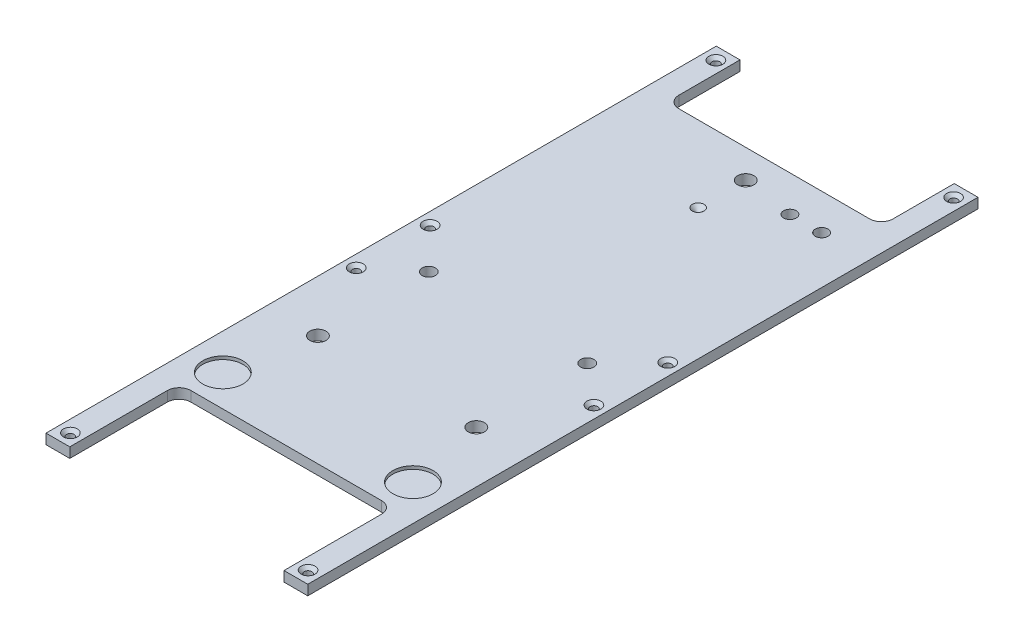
SolidWorks part; units mm, degrees
ref_plane "Front Plane" through (0, 0, 0) normal (0, 0, 1) x (1, 0, 0)
ref_plane "Top Plane" through (0, 0, 0) normal (0, 1, 0) x (1, 0, 0)
ref_plane "Right Plane" through (0, 0, 0) normal (1, 0, 0) x (0, 0, -1)
sketch "Sketch1" plane through (0, 0, 0) normal (0, 1, 0) x (1, 0, 0)
  line L0 (0, 0) -> (0, -130) construction
  line L1 (-41.3, 24) -> (41.3, 24)
  line L2 (-41.3, 24) -> (-41.3, -130)
  line L3 (-41.3, -130) -> (41.3, -130)
  line L4 (41.3, 24) -> (41.3, -130)
  point P0 (0, 0)
  dimension "D1" = 24
  dimension "D2" = 82.6
  dimension "D3" = 130
extrude "Plate" add sketch "Sketch1" along normal blind 3.175
sketch "Sketch32" plane through (0, 0, 0) normal (0, -1, 0) x (1, 0, 0)
  line L0 (-41.3, -24) -> (-41.3, -47)
  line L1 (-41.3, -47) -> (-33.8, -47)
  line L2 (-33.8, -47) -> (-33.8, -24)
  line L3 (41.3, -24) -> (-41.3, -24) construction
  line L4 (-33.8, -24) -> (-41.3, -24)
  line L5 (41.3, -24) -> (33.8, -24)
  line L6 (33.8, -24) -> (33.8, -47)
  line L7 (33.8, -47) -> (41.3, -47)
  line L8 (41.3, -47) -> (41.3, -24)
  line L9 (0, 0) -> (0, -48.1339) construction
  line L11 (-41.3, 130) -> (-33.8, 130)
  line L12 (-41.3, 130) -> (-41.3, 164.5)
  line L13 (-41.3, 164.5) -> (-33.8, 164.5)
  line L14 (-33.8, 130) -> (-33.8, 164.5)
  line L15 (41.3, 130) -> (33.8, 130)
  line L16 (41.3, 130) -> (41.3, 164.5)
  line L17 (41.3, 164.5) -> (33.8, 164.5)
  line L18 (33.8, 130) -> (33.8, 164.5)
  dimension "D1" = 7.5
  dimension "D2" = 23
  dimension "D3" = 211.5
extrude "Boss-Extrude3" add sketch "Sketch32" against normal up to surface (3.175 mm away)
fillet "Fillet1" radius 3.7 4 edges at (33.8, 1.5875, -24) (33.8, 1.5875, 130)
ref_plane "Plane1" through (0, 0, 53) normal (0, 0, 1) x (1, 0, 0)
ref_plane "Plane2" through (0, 0, 21) normal (0, 0, -1) x (-1, 0, 0)
ref_plane "Plane3" through (0, 0, 38) normal (0, 0, 1) x (1, 0, 0)
sketch "Sketch30" plane through (0, 0, 0) normal (0, 0, 1) x (1, 0, 0)
  line L0 (0, 1.325) -> (1.85, 3.175)
  line L1 (-30.1, 3.175) -> (30.1, 3.175) construction
  line L2 (1.85, 3.175) -> (0, 3.175)
  line L3 (0, 3.175) -> (0, 1.325)
  dimension "D1" = 1.85
revolve "Cone" cut sketch "Sketch30" angle 360 about L3
hole_wizard "CSK for M2 Flat Head Machine Screw1" positions "Sketch27" profile "Sketch28" countersink size "M2" standard "ANSI Metric"
sketch "Sketch27" plane through (0, 3.175, 0) normal (0, 1, 0) x (1, 0, 0)
  line L0 (30.1, 24) -> (-30.1, 24) construction
  line L2 (0, 24) -> (0, 0) construction
  line L5 (-37.5, 43.1) -> (-37.5, -47.1) construction
  line L6 (-37.5, -47.1) -> (-37.5, -70.4) construction
  line L9 (-37.5, -58.75) -> (-41.3, -58.75) construction
  line L10 (-41.3, 47) -> (-41.3, -164.5) construction
  point P0 (-37.5, 43.1)
  point P2 (37.5, 43.1)
  point P4 (37.5, -47.1)
  point P6 (-37.5, -47.1)
  point P23 (-37.5, -70.4)
  point P25 (37.5, -70.4)
  point P38 (-37.5, -160.6)
  point P40 (37.5, -160.6)
  dimension "D2" = 75
  dimension "D3" = 90.2
  dimension "D4" = 23.3
  dimension "D5" = 90.2
sketch "Sketch28" plane through (-37.5, 3.175, -43.1) normal (1, 0, 0) x (0, 0, 1)
  line L0 (0, 0) -> (0, 3.175)
  line L1 (0, 3.175) -> (1.2, 3.175)
  line L2 (1.2, 3.175) -> (1.2, 1)
  line L3 (1.2, 1) -> (2.2, 0)
  line L5 (2.2, 0) -> (0, 0)
  line L6 (-1.2, 1) -> (-2.2, 0) construction
  line L11 (0, -6.35) -> (0, 107.95) construction
  dimension "Thru Hole Dia." = 2.4
  dimension "Thru Hole Depth" = 3.175
  dimension "Near C'Sink Dia." = 4.4
  dimension "Near C'Sink Angle" = 90
sketch "Sketch17" plane through (0, 3.175, 0) normal (0, 1, 0) x (1, 0, 0)
  line L0 (0, 24) -> (0, -130) construction
  line L1 (30.1, 24) -> (-30.1, 24) construction
  line L2 (-30.1, -130) -> (30.1, -130) construction
  circle A0 centre (-30, -120) radius 6.35
  circle A1 centre (30, -120) radius 6.35
  dimension "D1" = 12.7
  dimension "D3" = 120
  dimension "D2" = 60
extrude "Flats" cut sketch "Sketch17" against normal blind 1
sketch "Sketch8" plane through (0, 0, 21) normal (0, 0, -1) x (-1, 0, 0)
  line L0 (0, 3.175) -> (0, 1.175)
  line L1 (30.1, 3.175) -> (-30.1, 3.175) construction
  line L2 (0, 1.175) -> (2, 3.175)
  line L3 (2, 3.175) -> (0, 3.175)
  dimension "D1" = 45
  dimension "D2" = 2
  dimension "D3" = 0
revolve "Cone Old" [suppressed] cut sketch "Sketch8" angle 360 about L0
hole_wizard "Bolt Hole 1/4-20 Tapped Hole1" positions "Sketch15" profile "Sketch14" tap size "1/4-20" standard "ANSI Inch"
sketch "Sketch15" plane through (0, 3.175, 0) normal (0, 1, 0) x (1, 0, 0)
  line L1 (-25, -95) -> (25, -95) construction
  line L3 (-30, -120) -> (30, -120) construction
  line L11 (0, -120) -> (0, -95) construction
  line L14 (0, 0) -> (0, -95) construction
  line L15 (0, 0) -> (0, 15) construction
  point P0 (-25, -95)
  point P2 (25, -95)
  point P59 (0, 15)
  dimension "D1" = 50
  dimension "D2" = 25
  dimension "D3" = 15
sketch "Sketch14" plane through (-25, 3.175, 95) normal (1, 0, 0) x (0, 0, 1)
  line L0 (0, 0) -> (0, 3.175)
  line L1 (0, 3.175) -> (2.5527, 3.175)
  line L2 (2.5527, 3.175) -> (2.5527, 0)
  line L5 (2.5527, 0) -> (0, 0)
  line L11 (0, -6.35) -> (0, 107.95) construction
  dimension "Thru Tap Drill Dia." = 5.1054
  dimension "Thru Tap Drill Depth" = 3.175
hole_wizard "Spring Hole M5x0.8 Tapped Hole1" positions "Sketch25" profile "Sketch24" tap size "M5x0.8" standard "ANSI Metric"
sketch "Sketch25" plane through (0, 3.175, 0) normal (0, 1, 0) x (1, 0, 0)
  line L0 (25, -95) -> (25, -130) construction
  line L1 (-30.1, -130) -> (30.1, -130) construction
  line L4 (-25, -95) -> (-25, -130) construction
  line L6 (-25, -60) -> (25, -60) construction
  point P0 (-25, -60)
  point P2 (25, -60)
  dimension "D1" = 60
sketch "Sketch24" plane through (-25, 3.175, 60) normal (1, 0, 0) x (0, 0, 1)
  line L0 (0, 0) -> (0, 3.175)
  line L1 (0, 3.175) -> (2.1, 3.175)
  line L2 (2.1, 3.175) -> (2.1, 0)
  line L5 (2.1, 0) -> (0, 0)
  line L11 (0, -6.35) -> (0, 107.95) construction
  dimension "Thru Tap Drill Dia." = 4.2
  dimension "Thru Tap Drill Depth" = 3.175
hole_wizard "#2-64 Tapped Hole1" positions "Sketch20" profile "Sketch19" tap size "#2-64" standard "ANSI Inch"
sketch "Sketch20" plane through (0, 3.175, 0) normal (0, 1, 0) x (1, 0, 0)
  line L0 (41.3, 24) -> (-41.3, 24) construction
  line L1 (-41.3, 24) -> (-41.3, -145) construction
  point P0 (-36.3, 9.875)
  dimension "D1" = 14.125
  dimension "D2" = 5
sketch "Sketch19" plane through (-36.3, 3.175, -9.875) normal (1, 0, 0) x (0, 0, 1)
  line L0 (0, 0) -> (0, 6.1342)
  line L1 (0, 6.1342) -> (0.889, 5.6)
  line L2 (0.889, 5.6) -> (0.889, 0)
  line L5 (0.889, 0) -> (0, 0)
  line L10 (0, 6.1342) -> (-0.889, 5.6) construction
  line L11 (0, -6.35) -> (0, 107.95) construction
  dimension "Tap Drill Dia." = 1.778
  dimension "Tap Drill Depth" = 5.6
  dimension "Drill Angle" = 118
hole_wizard "#2-64 Tapped Hole2" positions "Sketch22" profile "Sketch21" tap size "#2-64" standard "ANSI Inch"
sketch "Sketch22" plane through (0, 3.175, 0) normal (0, 1, 0) x (1, 0, 0)
  line L0 (20, 17) -> (-20, 17) construction
  line L2 (0, 17) -> (0, 0) construction
  line L4 (41.3, 27) -> (-41.3, 27) construction
  point P0 (-20, 17)
  point P3 (20, 17)
  dimension "D1" = 10
  dimension "D2" = 40
sketch "Sketch21" plane through (-20, 3.175, -17) normal (1, 0, 0) x (0, 0, 1)
  line L0 (0, 0) -> (0, 6.1342)
  line L1 (0, 6.1342) -> (0.889, 5.6)
  line L2 (0.889, 5.6) -> (0.889, 0)
  line L5 (0.889, 0) -> (0, 0)
  line L10 (0, 6.1342) -> (-0.889, 5.6) construction
  line L11 (0, -6.35) -> (0, 107.95) construction
  dimension "Tap Drill Dia." = 1.778
  dimension "Tap Drill Depth" = 5.6
  dimension "Drill Angle" = 118
sketch "Sketch23" plane through (0, 3.175, 0) normal (0, 1, 0) x (1, 0, 0)
  line L0 (0, 24) -> (0, -70.8) construction
  line L1 (30.1, 24) -> (-30.1, 24) construction
  line L2 (38.1, -70.8) -> (-38.1, -70.8) construction
  line L5 (-38.1, 20.8) -> (-38.1, -70.8) construction
  line L6 (-41.3, 47) -> (-41.3, -164.5) construction
  line L7 (-33.1, 20.8) -> (-33.1, 24)
  line L8 (-38.1, 15.8) -> (-41.3, 15.8)
  line L9 (-41.3, 15.8) -> (-41.3, 24)
  line L10 (-41.3, 24) -> (-33.1, 24)
  line L11 (33.1, 20.8) -> (33.1, 24)
  line L12 (38.1, 15.8) -> (41.3, 15.8)
  line L13 (41.3, -164.5) -> (41.3, 47) construction
  line L14 (41.3, 15.8) -> (41.3, 24)
  line L15 (41.3, 24) -> (33.1, 24)
  line L16 (38.1, -65.8) -> (41.3, -65.8)
  line L17 (38.1, -75.8) -> (41.3, -75.8)
  line L18 (41.3, -75.8) -> (41.3, -65.8)
  line L19 (-38.1, -75.8) -> (-41.3, -75.8)
  line L20 (-38.1, -65.8) -> (-41.3, -65.8)
  line L21 (-41.3, -65.8) -> (-41.3, -75.8)
  arc A0 (-38.1, -75.8) -> (-38.1, -65.8) centre (-38.1, -70.8) ccw
  arc A1 (38.1, -65.8) -> (38.1, -75.8) centre (38.1, -70.8) ccw
  arc A2 (33.1, 20.8) -> (38.1, 15.8) centre (38.1, 20.8) ccw
  arc A3 (-38.1, 15.8) -> (-33.1, 20.8) centre (-38.1, 20.8) ccw
  dimension "D2" = 10
  dimension "D1" = 91.6
  dimension "D3" = 3.2
  dimension "D4" = 3.2
extrude "Cut-Extrude2" [suppressed] cut sketch "Sketch23" against normal through all
sketch "Sketch29" plane through (0, 3.175, 0) normal (0, 1, 0) x (1, 0, 0)
  line L0 (-30.1, -130) -> (30.1, -130) construction
  line L1 (-41.3, -110) -> (41.3, -110)
  line L2 (-41.3, -110) -> (-41.3, -130)
  line L3 (-41.3, -130) -> (41.3, -130)
  line L4 (41.3, -110) -> (41.3, -130)
  dimension "D1" = 20
extrude "Boss-Extrude2" [suppressed] add sketch "Sketch29" against normal blind 3.175
sketch "Sketch31" plane through (0, 3.175, 0) normal (0, 1, 0) x (1, 0, 0)
  line L0 (41.3, -164.5) -> (41.3, 47) construction
  line L1 (30.1, 24) -> (-30.1, 24) construction
  circle A0 centre (26.3, 12.65) radius 2
  circle A1 centre (16.3, 12.65) radius 2
  dimension "D2" = 4
  dimension "D1" = 10
  dimension "D3" = 15
  dimension "D4" = 11.35
extrude "Cut-Extrude3" cut sketch "Sketch31" against normal up to next
